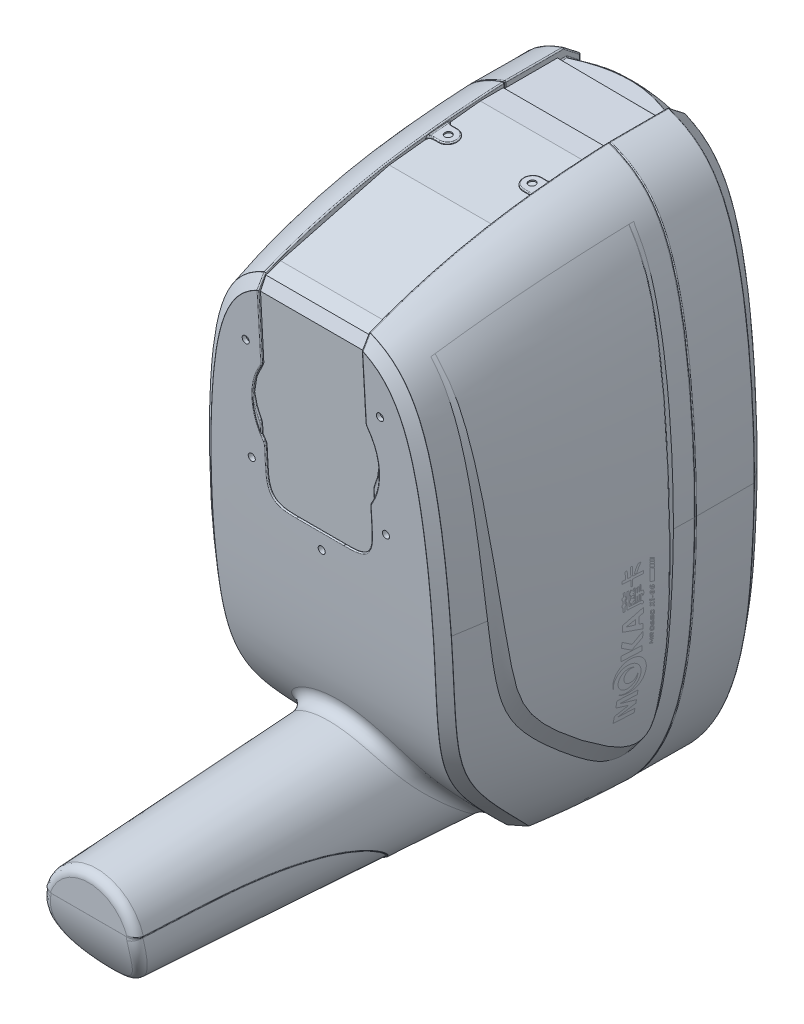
SolidWorks part; units mm, degrees
ref_plane "前视基准面" through (0, 0, 0) normal (0, 0, 1) x (1, 0, 0)
ref_plane "上视基准面" through (0, 0, 0) normal (0, 1, 0) x (1, 0, 0)
ref_plane "右视基准面" through (0, 0, 0) normal (1, 0, 0) x (0, 0, -1)
imported_body "输入1"
imported_body "曲面-输入1"
imported_body "曲面-输入2"
imported_body "曲面-输入3"
imported_body "曲面-输入4"
imported_body "曲面-输入5"
imported_body "曲面-输入6"
imported_body "曲面-输入7"
imported_body "曲面-输入8"
imported_body "曲面-输入9"
imported_body "曲面-输入10"
imported_body "曲面-输入11"
imported_body "曲面-输入12"
imported_body "曲面-输入13"
imported_body "曲面-输入14"
imported_body "曲面-输入15"
imported_body "曲面-输入16"
imported_body "曲面-输入17"
imported_body "曲面-输入18"
imported_body "曲面-输入19"
imported_body "曲面-输入20"
imported_body "曲面-输入21"
imported_body "曲面-输入22"
imported_body "曲面-输入23"
imported_body "曲面-输入24"
imported_body "曲面-输入25"
imported_body "曲面-输入26"
imported_body "曲面-输入27"
imported_body "曲面-输入28"
imported_body "曲面-输入29"
imported_body "曲面-输入30"
imported_body "曲面-输入31"
imported_body "曲面-输入32"
imported_body "曲面-输入33"
imported_body "曲面-输入34"
imported_body "曲面-输入35"
imported_body "曲面-输入36"
imported_body "曲面-输入37"
imported_body "曲面-输入38"
imported_body "曲面-输入39"
imported_body "曲面-输入40"
imported_body "曲面-输入41"
imported_body "曲面-输入42"
imported_body "曲面-输入43"
imported_body "曲面-输入44"
imported_body "曲面-输入45"
imported_body "曲面-输入46"
imported_body "曲面-输入47"
imported_body "曲面-输入48"
imported_body "曲面-输入49"
imported_body "曲面-输入50"
imported_body "曲面-输入51"
imported_body "曲面-输入52"
imported_body "曲面-输入53"
imported_body "曲面-输入54"
imported_body "曲面-输入55"
imported_body "曲面-输入56"
imported_body "曲面-输入57"
imported_body "曲面-输入58"
imported_body "曲面-输入59"
imported_body "曲面-输入60"
sketch "草图1" plane through (0, 0, 0) normal (1, 0, 0) x (0, 0, -1)
  line L0 (25.1456, 228.4229) -> (25.1456, 196.5615)
  line L1 (25.1456, 107.9652) -> (25.1456, 240.7957) construction
surface "曲面-拉伸1" sketch "草图1" parameters "D1"=251
other "移动面1" parameters "D1"=2
